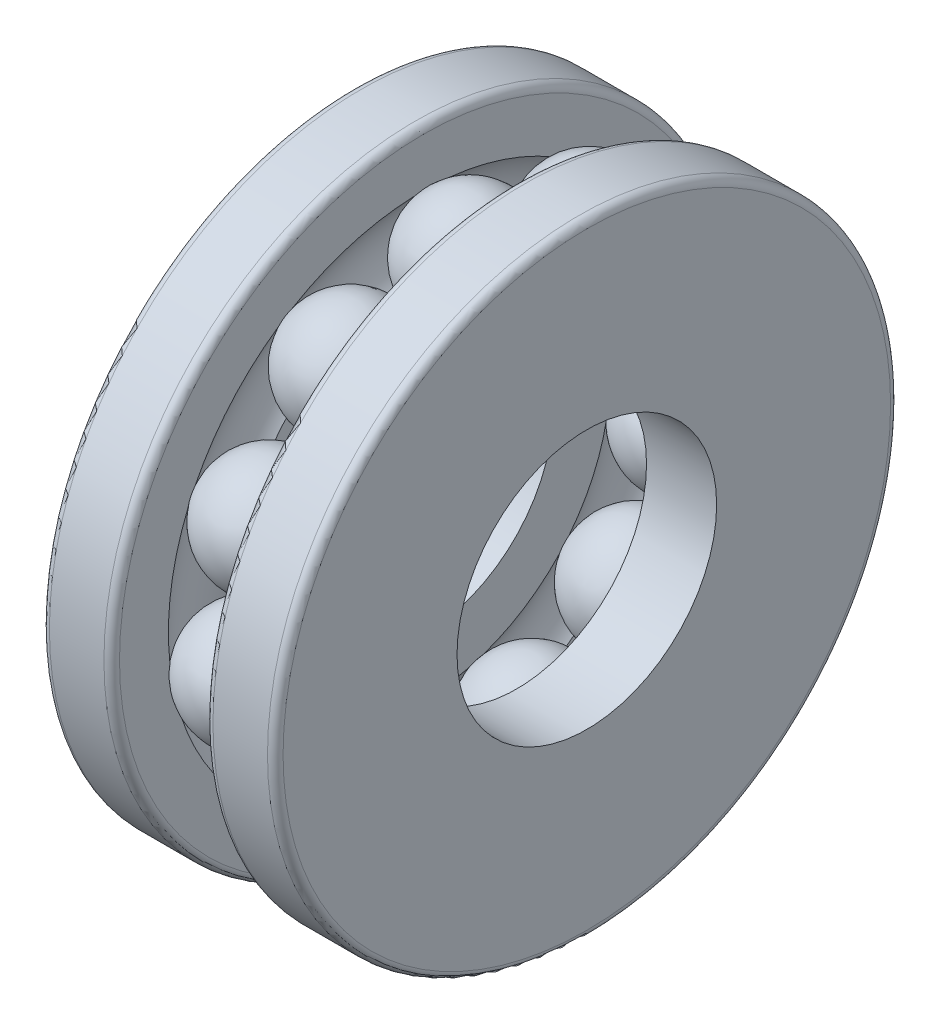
SolidWorks part; units mm, degrees
ref_plane "Front" through (0, 0, 0) normal (0, 0, 1) x (1, 0, 0)
ref_plane "Top" through (0, 0, 0) normal (0, 1, 0) x (1, 0, 0)
ref_plane "Right" through (0, 0, 0) normal (1, 0, 0) x (0, 0, -1)
other "Configuration Table"
sketch "Sketch1" plane through (0, 0, 0) normal (0, 0, 1) x (0, 1, 0)
  line L0 (0, 1.4099) -> (0, -1.5142) construction
  line L1 (6.25, 0) -> (10.75, 0)
  line L2 (4.3776, 0) -> (11.8663, 0) construction
  line L3 (8.5, 4.5) -> (13.0112, 4.5) construction
  line L4 (8.5, -4.5) -> (13.0112, -4.5) construction
  line L5 (5, 0) -> (5, 2.3607) construction
  line L6 (-5, 0) -> (-5, 2.3607) construction
  line L7 (12, 0) -> (12, 3.0588) construction
  line L8 (-12, 0) -> (-12, 3.0588) construction
  arc A0 (6.25, 0) -> (10.75, 0) centre (8.5, 0) ccw
revolve "Revolve1" add sketch "Sketch1" angle 360 about L2
sketch "Sketch2" plane through (0, 0, 0) normal (0, 0, 1) x (0, 1, 0)
  line L0 (5, 4.5) -> (5, 1.8)
  line L1 (5, 1.8) -> (7.1836, 1.8)
  line L2 (5, 4.5) -> (12, 4.5)
  line L3 (12, 4.5) -> (12, 1.8)
  line L4 (12, 1.8) -> (9.8164, 1.8)
  line L5 (0, 4.8736) -> (0, -4.1797) construction
  line L6 (-8.0647, 0) -> (13.4529, 0) construction
  arc A0 (9.8164, 1.8) -> (7.1836, 1.8) centre (8.5, 0) ccw
  circle A1 centre (8.5, 0) radius 2.25 construction
revolve "Revolve2" add sketch "Sketch2" angle 360 about L5
sketch "Sketch3" plane through (0, 0, 0) normal (0, 0, 1) x (0, 1, 0)
  line L0 (-2.5215, 0) -> (12.4263, 0) construction
  line L1 (5, -1.8) -> (7.1836, -1.8)
  line L2 (5, -1.8) -> (5, -4.5)
  line L3 (5, -4.5) -> (12, -4.5)
  line L4 (12, -1.8) -> (12, -4.5)
  line L5 (0, 8.7259) -> (0, -4.9884) construction
  line L6 (9.8164, -1.8) -> (12, -1.8)
  arc A0 (7.15, 1.8) -> (9.85, 1.8) centre (8.5, 0) ccw construction
  arc A1 (7.1836, -1.8) -> (9.8164, -1.8) centre (8.5, 0) ccw
revolve "Revolve3" add sketch "Sketch3" angle 360 about L5
pattern_circular "Circular-Pattern1" count 11 over 360 about axis through (0, 0, 0) along (1, 0, 0) of "Revolve1"
fillet "Fillet1" radius 0.3 4 edges at (4.5, 0, 12) (1.8, 0, 12) (-1.8, 0, 12) (-4.5, 0, 12)
equation "\"d0@Sketch1\" = \"T@Sketch1\" / 2"
equation "\"dd0@Sketch1\" =  ( \"d@Sketch1\" + \"DD@Sketch1\" )  / 2"
equation "\"D@Sketch2\" = \"DD@Sketch1\""
equation "\"T@Sketch2\" = \"T@Sketch1\""
equation "\"dd1@Sketch2\" = \"d0@Sketch1\" - 0.04"
equation "\"B1/2@Sketch2\" = \"T@Sketch2\" / 5"
equation "\"d@Sketch3\" = \"d@Sketch1\""
equation "\"D2@Sketch3\" = \"B1/2@Sketch2\""
equation "\"D1@Sketch3\" = \"dd1@Sketch2\""
equation "\"T@Sketch3\" = \"T@Sketch2\""
equation "\"m@Circular-Pattern1\" = int( 3.14159265 / atn((  \"d0@Sketch1\"/ 2) / sqr( \"dd0@Sketch1\"/2 * \"dd0@Sketch1\"/2 - ( \"d0@Sketch1\"/ 2) *  ( \"d0@Sketch1\" / 2))))"
